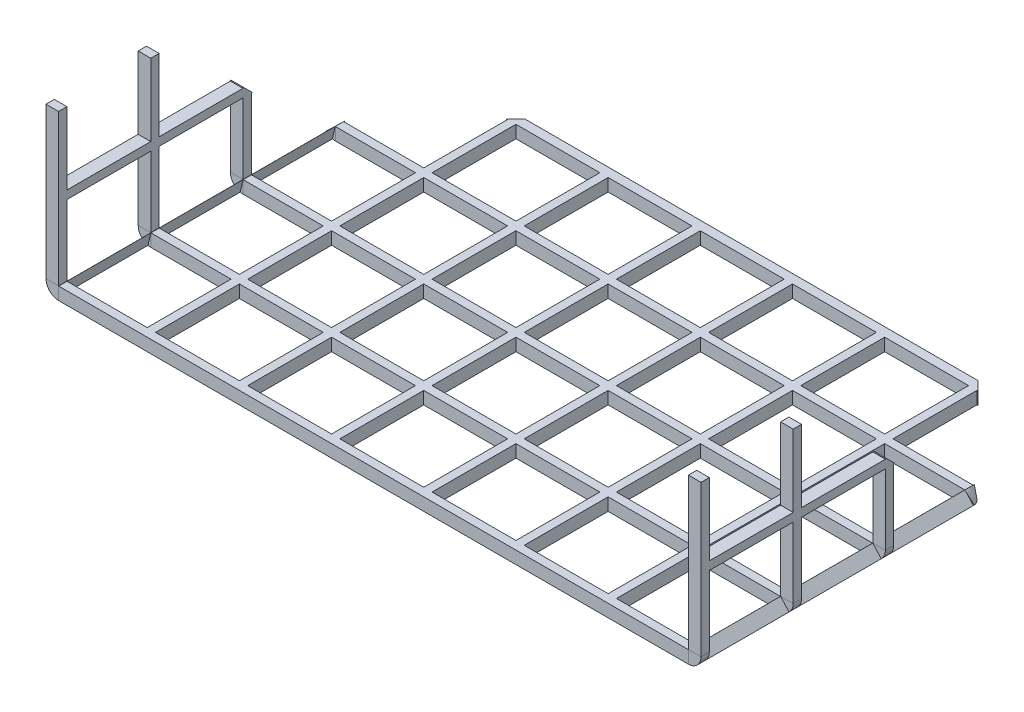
SolidWorks part; units mm, degrees
ref_plane "Front" through (0, 0, 0) normal (0, 0, 1) x (1, 0, 0)
ref_plane "Top" through (0, 0, 0) normal (0, 1, 0) x (1, 0, 0)
ref_plane "Right" through (0, 0, 0) normal (1, 0, 0) x (0, 0, -1)
sketch "Sketch1" plane through (0, 0, 0) normal (0, 1, 0) x (1, 0, 0)
  line L0 (64.29, 22.71) -> (65.04, 21.96)
  line L1 (0, 0) -> (78, 0)
  line L2 (0, 0) -> (0, 0.66)
  line L3 (21, 30) -> (57, 30)
  line L4 (78, 0) -> (78, 0.66)
  line L5 (71.61, 15.39) -> (72.36, 14.64)
  line L6 (78, 7.32) -> (78, 7.98)
  line L7 (21, 30) -> (20.28, 29.28)
  line L8 (57, 30) -> (57.72, 29.28)
  line L9 (0, 7.32) -> (0, 7.98)
  line L10 (42.99, 7.32) -> (49.65, 7.32)
  line L11 (35.67, 7.32) -> (35.67, 0.66)
  line L12 (42.33, 7.32) -> (42.33, 0.66)
  line L13 (49.65, 7.32) -> (49.65, 0.66)
  line L14 (42.99, 0.66) -> (49.65, 0.66)
  line L15 (42.99, 7.32) -> (42.99, 0.66)
  line L16 (50.31, 7.32) -> (56.97, 7.32)
  line L17 (56.97, 7.32) -> (56.97, 0.66)
  line L18 (35.67, 7.32) -> (42.33, 7.32)
  line L19 (50.31, 0.66) -> (56.97, 0.66)
  line L20 (35.67, 0.66) -> (42.33, 0.66)
  line L21 (50.31, 7.32) -> (50.31, 0.66)
  line L22 (57.63, 7.32) -> (64.29, 7.32)
  line L23 (64.29, 7.32) -> (64.29, 0.66)
  line L24 (57.63, 0.66) -> (64.29, 0.66)
  line L25 (57.63, 7.32) -> (57.63, 0.66)
  line L26 (64.95, 7.32) -> (71.61, 7.32)
  line L27 (71.61, 7.32) -> (71.61, 0.66)
  line L28 (64.95, 0.66) -> (71.61, 0.66)
  line L29 (64.95, 7.32) -> (64.95, 0.66)
  line L30 (72.27, 7.32) -> (78, 7.32)
  line L31 (6.39, 15.39) -> (5.64, 14.64)
  line L32 (72.27, 0.66) -> (78, 0.66)
  line L33 (72.27, 7.32) -> (72.27, 0.66)
  line L34 (28.35, 7.32) -> (35.01, 7.32)
  line L35 (35.01, 7.32) -> (35.01, 0.66)
  line L36 (28.35, 0.66) -> (35.01, 0.66)
  line L37 (28.35, 7.32) -> (28.35, 0.66)
  line L38 (21.03, 7.32) -> (27.69, 7.32)
  line L39 (27.69, 7.32) -> (27.69, 0.66)
  line L40 (21.03, 0.66) -> (27.69, 0.66)
  line L41 (21.03, 7.32) -> (21.03, 0.66)
  line L42 (13.71, 7.32) -> (20.37, 7.32)
  line L43 (20.37, 7.32) -> (20.37, 0.66)
  line L44 (13.71, 0.66) -> (20.37, 0.66)
  line L45 (13.71, 7.32) -> (13.71, 0.66)
  line L46 (6.39, 7.32) -> (13.05, 7.32)
  line L47 (13.05, 7.32) -> (13.05, 0.66)
  line L48 (6.39, 0.66) -> (13.05, 0.66)
  line L49 (6.39, 7.32) -> (6.39, 0.66)
  line L50 (0, 7.32) -> (5.73, 7.32)
  line L51 (5.73, 7.32) -> (5.73, 0.66)
  line L52 (0, 0.66) -> (5.73, 0.66)
  line L53 (13.71, 22.71) -> (12.96, 21.96)
  line L54 (35.67, 14.64) -> (42.33, 14.64)
  line L55 (42.33, 14.64) -> (42.33, 7.98)
  line L56 (35.67, 7.98) -> (42.33, 7.98)
  line L57 (35.67, 14.64) -> (35.67, 7.98)
  line L58 (35.67, 21.96) -> (42.33, 21.96)
  line L59 (42.33, 21.96) -> (42.33, 15.3)
  line L60 (35.67, 15.3) -> (42.33, 15.3)
  line L61 (35.67, 21.96) -> (35.67, 15.3)
  line L62 (35.67, 29.28) -> (42.33, 29.28)
  line L63 (42.33, 29.28) -> (42.33, 22.62)
  line L64 (35.67, 22.62) -> (42.33, 22.62)
  line L65 (35.67, 29.28) -> (35.67, 22.62)
  line L66 (42.99, 14.64) -> (49.65, 14.64)
  line L67 (49.65, 14.64) -> (49.65, 7.98)
  line L68 (42.99, 14.64) -> (42.99, 7.98)
  line L69 (42.99, 21.96) -> (49.65, 21.96)
  line L70 (49.65, 21.96) -> (49.65, 15.3)
  line L71 (42.99, 15.3) -> (49.65, 15.3)
  line L72 (42.99, 21.96) -> (42.99, 15.3)
  line L73 (42.99, 29.28) -> (49.65, 29.28)
  line L74 (49.65, 29.28) -> (49.65, 22.62)
  line L75 (42.99, 22.62) -> (49.65, 22.62)
  line L76 (42.99, 29.28) -> (42.99, 22.62)
  line L77 (42.99, 7.98) -> (49.65, 7.98)
  line L78 (50.31, 14.64) -> (56.97, 14.64)
  line L79 (56.97, 14.64) -> (56.97, 7.98)
  line L80 (50.31, 14.64) -> (50.31, 7.98)
  line L81 (50.31, 21.96) -> (56.97, 21.96)
  line L82 (56.97, 21.96) -> (56.97, 15.3)
  line L83 (50.31, 15.3) -> (56.97, 15.3)
  line L84 (50.31, 21.96) -> (50.31, 15.3)
  line L85 (50.31, 29.28) -> (56.97, 29.28)
  line L86 (56.97, 29.28) -> (56.97, 22.62)
  line L87 (50.31, 22.62) -> (56.97, 22.62)
  line L88 (50.31, 29.28) -> (50.31, 22.62)
  line L89 (50.31, 7.98) -> (56.97, 7.98)
  line L90 (57.63, 14.64) -> (64.29, 14.64)
  line L91 (64.29, 14.64) -> (64.29, 7.98)
  line L92 (57.63, 14.64) -> (57.63, 7.98)
  line L93 (57.63, 21.96) -> (64.29, 21.96)
  line L94 (64.29, 21.96) -> (64.29, 15.3)
  line L95 (57.63, 15.3) -> (64.29, 15.3)
  line L96 (57.63, 21.96) -> (57.63, 15.3)
  line L97 (57.63, 29.28) -> (57.72, 29.28)
  line L98 (64.29, 22.71) -> (64.29, 22.62)
  line L99 (57.63, 22.62) -> (64.29, 22.62)
  line L100 (57.63, 29.28) -> (57.63, 22.62)
  line L101 (57.63, 7.98) -> (64.29, 7.98)
  line L102 (64.95, 14.64) -> (71.61, 14.64)
  line L103 (71.61, 14.64) -> (71.61, 7.98)
  line L104 (64.95, 14.64) -> (64.95, 7.98)
  line L105 (64.95, 21.96) -> (65.04, 21.96)
  line L106 (71.61, 15.39) -> (71.61, 15.3)
  line L107 (64.95, 15.3) -> (71.61, 15.3)
  line L108 (64.95, 21.96) -> (64.95, 15.3)
  line L113 (64.95, 7.98) -> (71.61, 7.98)
  line L114 (72.27, 14.64) -> (72.36, 14.64)
  line L116 (72.27, 14.64) -> (72.27, 7.98)
  line L125 (72.27, 7.98) -> (78, 7.98)
  line L126 (28.35, 14.64) -> (35.01, 14.64)
  line L127 (35.01, 14.64) -> (35.01, 7.98)
  line L128 (28.35, 14.64) -> (28.35, 7.98)
  line L129 (28.35, 21.96) -> (35.01, 21.96)
  line L130 (35.01, 21.96) -> (35.01, 15.3)
  line L131 (28.35, 15.3) -> (35.01, 15.3)
  line L132 (28.35, 21.96) -> (28.35, 15.3)
  line L133 (28.35, 29.28) -> (35.01, 29.28)
  line L134 (35.01, 29.28) -> (35.01, 22.62)
  line L135 (28.35, 22.62) -> (35.01, 22.62)
  line L136 (28.35, 29.28) -> (28.35, 22.62)
  line L137 (28.35, 7.98) -> (35.01, 7.98)
  line L138 (21.03, 14.64) -> (27.69, 14.64)
  line L139 (27.69, 14.64) -> (27.69, 7.98)
  line L140 (21.03, 14.64) -> (21.03, 7.98)
  line L141 (21.03, 21.96) -> (27.69, 21.96)
  line L142 (27.69, 21.96) -> (27.69, 15.3)
  line L143 (21.03, 15.3) -> (27.69, 15.3)
  line L144 (21.03, 21.96) -> (21.03, 15.3)
  line L145 (21.03, 29.28) -> (27.69, 29.28)
  line L146 (27.69, 29.28) -> (27.69, 22.62)
  line L147 (21.03, 22.62) -> (27.69, 22.62)
  line L148 (21.03, 29.28) -> (21.03, 22.62)
  line L149 (21.03, 7.98) -> (27.69, 7.98)
  line L150 (13.71, 14.64) -> (20.37, 14.64)
  line L151 (20.37, 14.64) -> (20.37, 7.98)
  line L152 (13.71, 14.64) -> (13.71, 7.98)
  line L153 (13.71, 21.96) -> (20.37, 21.96)
  line L154 (20.37, 21.96) -> (20.37, 15.3)
  line L155 (13.71, 15.3) -> (20.37, 15.3)
  line L156 (13.71, 21.96) -> (13.71, 15.3)
  line L157 (20.28, 29.28) -> (20.37, 29.28)
  line L158 (20.37, 29.28) -> (20.37, 22.62)
  line L159 (13.71, 22.62) -> (20.37, 22.62)
  line L160 (13.71, 22.71) -> (13.71, 22.62)
  line L161 (13.71, 7.98) -> (20.37, 7.98)
  line L162 (6.39, 14.64) -> (13.05, 14.64)
  line L163 (13.05, 14.64) -> (13.05, 7.98)
  line L164 (6.39, 14.64) -> (6.39, 7.98)
  line L165 (12.96, 21.96) -> (13.05, 21.96)
  line L166 (13.05, 21.96) -> (13.05, 15.3)
  line L167 (6.39, 15.3) -> (13.05, 15.3)
  line L168 (6.39, 15.39) -> (6.39, 15.3)
  line L173 (6.39, 7.98) -> (13.05, 7.98)
  line L174 (5.64, 14.64) -> (5.73, 14.64)
  line L175 (5.73, 14.64) -> (5.73, 7.98)
  line L185 (0, 7.98) -> (5.73, 7.98)
  line L186 (64.95, 29.28) -> (64.95, 22.62)
  line L187 (64.95, 22.62) -> (71.61, 22.62)
  line L188 (72.27, 21.96) -> (72.27, 15.3)
  line L189 (72.27, 15.3) -> (78.93, 15.3)
  line L190 (78.93, 14.64) -> (78.93, 7.98)
  line L191 (13.05, 29.28) -> (13.05, 22.62)
  line L192 (6.39, 22.62) -> (13.05, 22.62)
  line L193 (5.73, 21.96) -> (5.73, 15.3)
  line L194 (-0.93, 15.3) -> (5.73, 15.3)
  line L195 (-0.93, 14.64) -> (-0.93, 7.98)
  line L196 (6.39, 29.28) -> (13.05, 29.28)
  line L197 (6.39, 29.28) -> (6.39, 22.62)
  line L198 (5.73, 29.28) -> (5.73, 22.62)
  line L199 (-0.93, 29.28) -> (5.73, 29.28)
  line L200 (-0.93, 29.28) -> (-0.93, 22.62)
  line L201 (-0.93, 22.62) -> (5.73, 22.62)
  line L202 (-0.93, 21.96) -> (5.73, 21.96)
  line L203 (-0.93, 21.96) -> (-0.93, 15.3)
  line L204 (64.95, 29.28) -> (71.61, 29.28)
  line L205 (71.61, 29.28) -> (71.61, 22.62)
  line L206 (72.27, 29.28) -> (72.27, 22.62)
  line L207 (72.27, 29.28) -> (78.93, 29.28)
  line L208 (78.93, 29.28) -> (78.93, 22.62)
  line L209 (72.27, 22.62) -> (78.93, 22.62)
  line L210 (72.27, 21.96) -> (78.93, 21.96)
  line L211 (78.93, 21.96) -> (78.93, 15.3)
  line L212 (-0.93, 7.32) -> (-0.93, 0.66)
  line L213 (78.93, 7.32) -> (78.93, 0.66)
sheet metal parameters "Sheet-Metal1" thickness 1 parameters "D1"=0
base flange "Base-Flange1" sketch "Sketch1" thickness 1 reverse thickness direction yes parameters "D1"=0
sketch "Sketch3" plane through (0, 1, 0) normal (0, 1, 0) x (-1, 0, 0)
  line L3 (-13, -30) -> (-13, 0)
  line L4 (-65, -30) -> (-65, 0)
sketched bend "Sketched Bend2" parameters "D1"=0.01
bend "SketchBend2" bend radius 0.01 bend angle 90 parameters "D5"=1
bend "SketchBend3" bend radius 0.01 bend angle 90 parameters "D5"=2
flat pattern "Flat-Pattern1"
sketch "Bend-Lines1" plane through (0, 1, 0) normal (0, 1, 0) x (-1, 0, 0)
  line L0 (-65, -22) -> (-65, 0) construction
  line L1 (-13, -22) -> (-13, 0) construction
bend of the flat pattern "Flatten-<SketchBend2>1"
bend of the flat pattern "Flatten-<SketchBend3>1"
